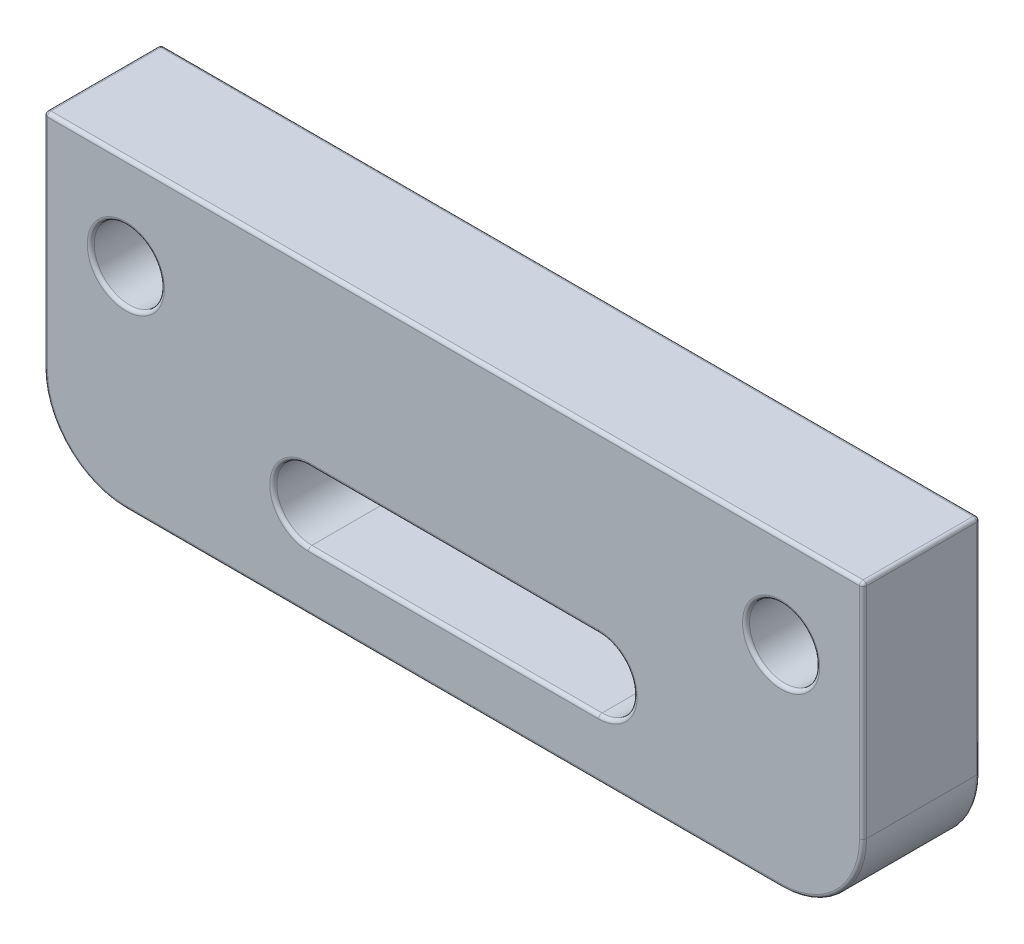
SolidWorks part; units mm, degrees
ref_plane "Front Plane" through (0, 0, 0) normal (0, 0, 1) x (1, 0, 0)
ref_plane "Top Plane" through (0, 0, 0) normal (0, 1, 0) x (1, 0, 0)
ref_plane "Right Plane" through (0, 0, 0) normal (1, 0, 0) x (0, 0, -1)
sketch "Sketch1" plane through (0, 0, 0) normal (0, 0, 1) x (1, 0, 0)
  line L0 (0, -19) -> (0, 26) construction
  line L1 (11.5, -6) -> (-11.5, -6)
  line L2 (11.5, -6) -> (11.5, 6)
  line L3 (11.5, 6) -> (-11.5, 6)
  line L4 (-11.5, -6) -> (-11.5, 6)
  line L5 (11.5, -6) -> (-11.5, 6) construction
  line L6 (11.5, 6) -> (-11.5, -6) construction
  line L7 (-6.2, -15) -> (6.2, -15) construction
  line L8 (-6.2, -13.5) -> (6.2, -13.5)
  line L9 (-6.2, -16.5) -> (6.2, -16.5)
  line L11 (-17.5, 9) -> (17.5, 9) construction
  line L12 (-17.5, 9) -> (-17.5, -19)
  line L13 (-17.5, -19) -> (17.5, -19)
  line L14 (17.5, 9) -> (17.5, -19)
  circle A0 centre (-14, 0) radius 1
  circle A1 centre (-14, -10) radius 1.5
  arc A2 (-6.2, -13.5) -> (-6.2, -16.5) centre (-6.2, -15) ccw
  arc A3 (6.2, -16.5) -> (6.2, -13.5) centre (6.2, -15) ccw
  circle A4 centre (-8.5, 16) radius 2
  circle A5 centre (14, -10) radius 1.5
  circle A6 centre (14, 0) radius 1
  circle A7 centre (8.5, 16) radius 2
  arc A8 (-17.5, 9) -> (17.5, 9) centre (0, 8.4926) cw
  point P0 (0, 0)
  point P10 (-11.5, 0)
  point P11 (0, -15)
  point P33 (0, 26)
  dimension "D5" = 2
  dimension "D7" = 3
  dimension "D9" = 1.5
  dimension "D12" = 10
  dimension "D13" = 4
  dimension "D1" = 23
  dimension "D2" = 12
  dimension "D3" = 45
  dimension "D4" = 13
  dimension "D6" = 2.5
  dimension "D8" = 10
  dimension "D10" = 12.4
  dimension "D11" = 4
  dimension "D14" = 8.5
  dimension "D15" = 28
  dimension "D16" = 35
  dimension "D17" = 13
extrude "Boss-Extrude1" add sketch "Sketch1" along normal blind 5
fillet "Fillet1" radius 3.5 2 edges at (17.5, -19, 2.5) (-17.5, -19, 2.5)
sketch "Sketch2" plane through (0, 0, 5) normal (0, 0, 1) x (1, 0, 0)
  line L0 (-22.5, -6) -> (27.5, -6)
  line L3 (-11.5, -6) -> (11.5, -6) construction
  line L4 (-17.5, 9) -> (-17.5, -15.5) construction
  dimension "D1" = 50
  dimension "D2" = 5
extrude "Cut-Extrude1" cut sketch "Sketch2" against normal through all both and the other way through all
fillet "Fillet3" radius 0.15 26 edges at (-16.4749, -17.9749, 0) (0, -19, 0) (16.4749, -17.9749, 0) (17.5, -10.75, 0) (0, -6, 0) (-17.5, -10.75, 0) (-12.5, -10, 0) (7.7, -15, 0) (0, -16.5, 0) (-7.7, -15, 0) (0, -13.5, 0) (12.5, -10, 0) (17.5, -10.75, 5) (16.4749, -17.9749, 5) (0, -19, 5) (-16.4749, -17.9749, 5) (-17.5, -10.75, 5) (0, -6, 5) (-12.5, -10, 5) (0, -16.5, 5) (7.7, -15, 5) (0, -13.5, 5) (-7.7, -15, 5) (12.5, -10, 5) (17.5, -6, 2.5) (-17.5, -6, 2.5)
